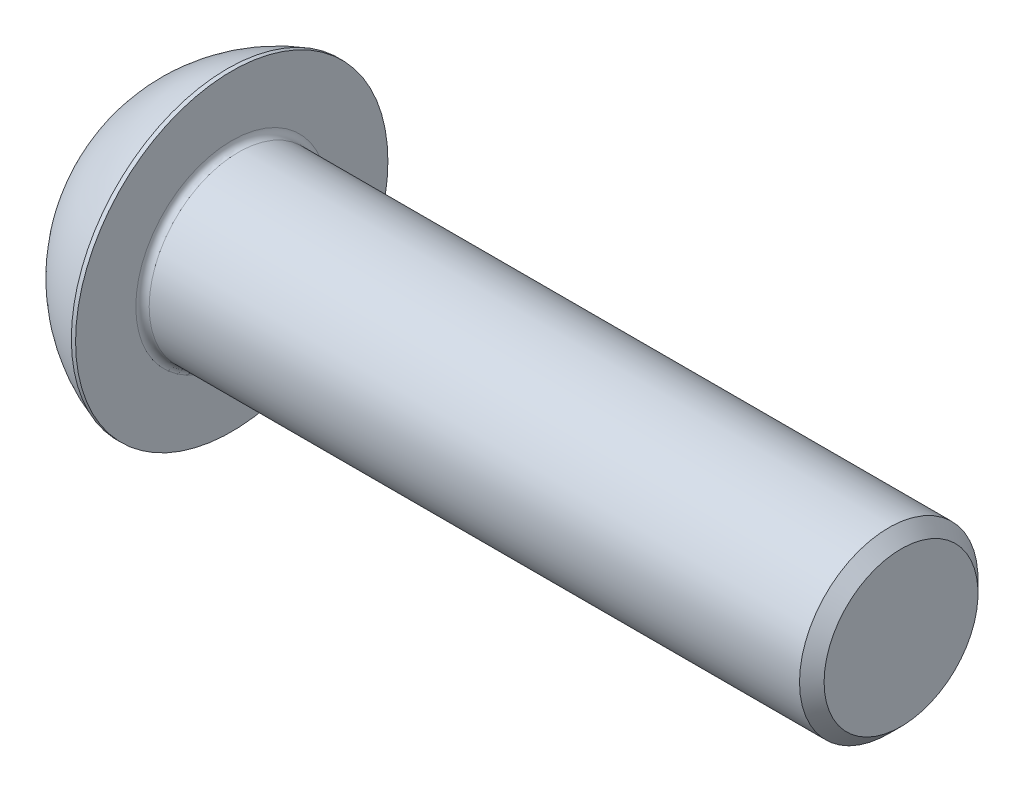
SolidWorks part; units mm, degrees
ref_plane "Plane1" through (0, 0, 0) normal (0, 0, 1) x (1, 0, 0)
ref_plane "Plane2" through (0, 0, 0) normal (0, 1, 0) x (1, 0, 0)
ref_plane "Plane3" through (0, 0, 0) normal (1, 0, 0) x (0, 0, -1)
sketch "BodySke" plane through (0, 0, 0) normal (0, 0, 1) x (1, 0, 0)
  line L0 (68.8, 0) -> (68.8, 6.8985)
  line L1 (67.6985, 8) -> (8.8, 8)
  line L2 (8.8, 8) -> (8.8, 14)
  line L3 (8.8, 14) -> (8.42, 14)
  line L4 (0, 0) -> (101.6, 0) construction
  line L5 (8.8, -14) -> (8.42, -14) construction
  line L6 (55.6768, -8) -> (8.8, -8) construction
  line L7 (68.8, 0) -> (0, 0)
  line L8 (0, 7) -> (0, -7) construction
  line L9 (0, 0) -> (0, 7)
  line L10 (68.8, 6.8985) -> (67.6985, 8)
  line L11 (68.8, -6.8985) -> (67.6985, -8) construction
  line L12 (10.8, 9.525) -> (10.8, -8) construction
  line L13 (8.8, 9.525) -> (8.8, -8) construction
  arc A1 (0, 7) -> (8.42, 14) centre (12.9392, 0) cw
  dimension "D1" = 14
  dimension "Diameter" = 16
  dimension "Length" = 60
  dimension "Head_dia" = 28
  dimension "Head_ht" = 8.8
  dimension "Head_side_ht" = 0.38
  dimension "Minor_dia" = 13.797
  dimension "Body_ch_ang" = 45
  dimension "Advance" = 2
  dimension "Thread_nom" = 60
revolve "BaseBody" add sketch "BodySke" angle 360 about L4
fillet "Fillet1" radius 0.6 1 edges at (8.8, 0, 8)
sketch "Sketch2" plane through (0, 0, 0) normal (0, 0, 1) x (1, 0, 0)
  line L0 (0, 5) -> (3.0988, 5)
  line L1 (3.0988, 5) -> (5.9856, 0)
  line L3 (5.9856, 0) -> (0, 0)
  line L4 (0, 0) -> (0, 5)
  line L5 (0, -5) -> (3.0988, -5) construction
  line L6 (0, 0) -> (47.625, 0) construction
  dimension "D2" = 60
  dimension "PreBroach_depth" = 3.0988
  dimension "PreBroach_dia" = 10
revolve "PreBroach" cut sketch "Sketch2" angle 360 about L6
sketch "Sketch3" plane through (0, 0, 0) normal (1, 0, 0) x (0, 0, -1)
  line L0 (-5, -2.8868) -> (-5, 2.8868)
  line L1 (-5, 2.8868) -> (0, 5.7735)
  line L2 (0, 5.7735) -> (5, 2.8868)
  line L3 (5, 2.8868) -> (5, -2.8868)
  line L4 (5, -2.8868) -> (0, -5.7735)
  line L5 (0, -5.7735) -> (-5, -2.8868)
  dimension "D1" = 5
  dimension "D2" = 5
  dimension "D3" = 10
  dimension "Hex_size" = 10
extrude "Hex" cut sketch "Sketch3" along normal blind 3.0988
sketch "ThdSchSke" plane through (0, 0, 0) normal (0, 0, 1) x (1, 0, 0)
  line L0 (12.8, -6.8985) -> (12.0287, -8)
  line L1 (12.8, -6.8985) -> (13.5713, -8)
  line L2 (13.5713, -8) -> (13.5713, -10)
  line L3 (-3.175, 0) -> (5.1513, 0) construction
  line L5 (13.5713, -10) -> (12.0287, -10)
  line L6 (12.0287, -10) -> (12.0287, -8)
  dimension "Thread_minor" = 13.797
  dimension "Diameter" = 16
  dimension "Start" = 12.8
  dimension "SideAngle" = 55
  dimension "VeeAngle" = 70
  dimension "Overcut" = 20
revolve "ThreadSchematic" [suppressed] cut sketch "ThdSchSke" angle 360 about L3
pattern_linear "ThdSchPat" [suppressed]
equation "\"D1@BodySke\" = \"Head_dia@BodySke\" * .5"
equation "\"Thread_minor@ThreadCosmetic\" = \"Minor_dia@BodySke\""
equation "\"D1@Sketch3\" = \"Hex_size@Sketch3\" / 2"
equation "\"D2@Sketch3\" = \"D1@Sketch3\""
equation "\"D3@Sketch3\" = \"Hex_size@Sketch3\""
equation "\"Thread_length@ThreadCosmetic\" = ((sgn( (\"Length@BodySke\" - \"Advance@BodySke\" * 2.0) - \"Thread_nom@BodySke\" )-1)*( (\"Length@BodySke\" - \"Advance@BodySke\" * 2.0) - \"Thread_nom@BodySke\" ))/-2+ \"Thread_no"
equation "\"Thread_minor@ThdSchSke\" = \"Minor_dia@BodySke\""
equation "\"Diameter@ThdSchSke\" = \"Diameter@BodySke\""
equation "\"Overcut@ThdSchSke\" = \"Diameter@BodySke\" * 1.25"
equation "\"Start@ThdSchSke\" = \"Head_ht@BodySke\" + \"Length@BodySke\" - \"Thread_length@ThreadCosmetic\"  '---Non-countersunk---"
equation "\"Num_threads@ThdSchPat\" = int( \"Thread_length@ThreadCosmetic\" / \"Advance@BodySke\" + 0.999 )  + 1"
equation "\"Advance@ThdSchPat\" = \"Thread_length@ThreadCosmetic\" /  (\"Num_threads@ThdSchPat\" - 1) 'relax it"
equation "\"Num_threads@ThdSchPat\" = \"Num_threads@ThdSchPat\" - sgn( \"Num_threads@ThdSchPat\" - 1) '---chamfered tips only---"
